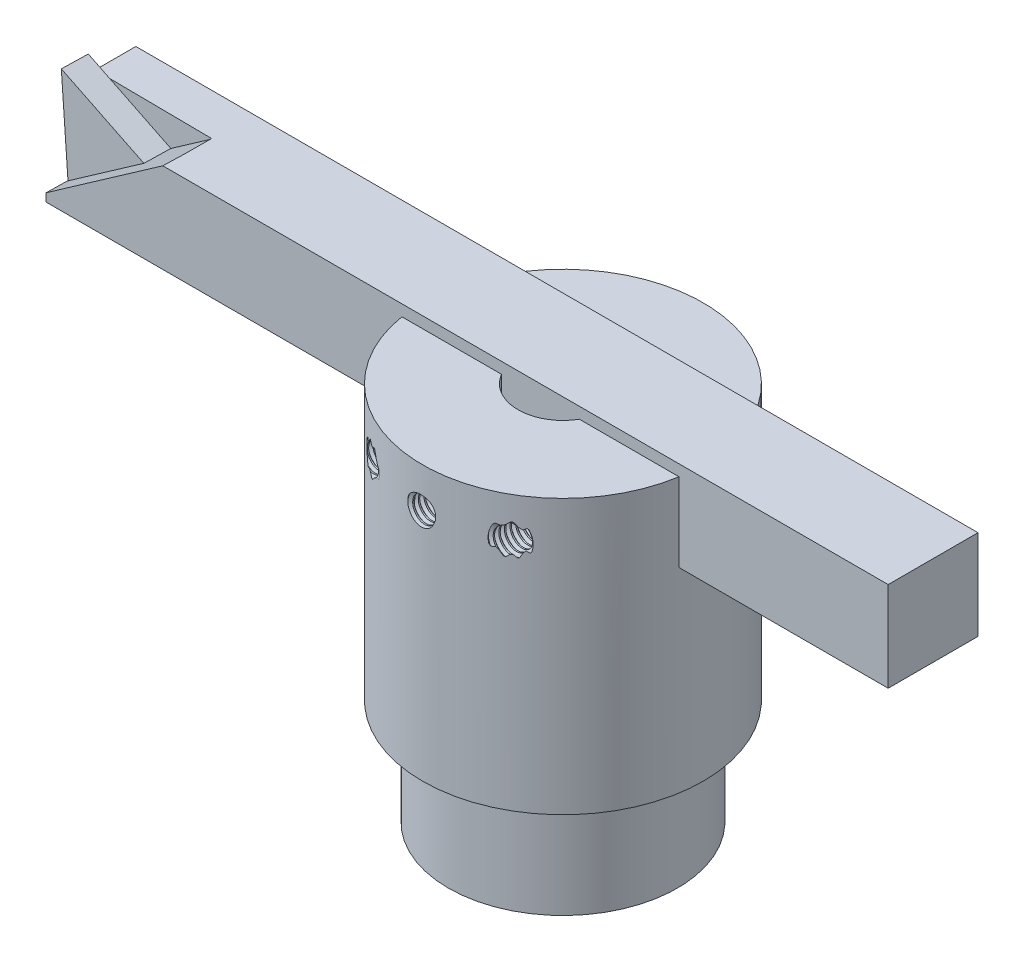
SolidWorks part; units mm, degrees
other "Arbor"
other "Fly Cutter Body"
other "Tool Holder"
other "Insert"
ref_plane "Front Plane" through (0, 0, 0) normal (0, 0, 1) x (1, 0, 0)
ref_plane "Top Plane" through (0, 0, 0) normal (0, 1, 0) x (1, 0, 0)
ref_plane "Right Plane" through (0, 0, 0) normal (1, 0, 0) x (0, 0, -1)
sketch "Sketch1" plane through (0, 0, 0) normal (0, 1, 0) x (1, 0, 0)
  circle A0 centre (0, 0) radius 20.4
  dimension "D1" = 40.8
extrude "Boss-Extrude1" add sketch "Sketch1" against normal blind 18.8
sketch "Sketch2" plane through (0, 0, 0) normal (0, 1, 0) x (1, 0, 0)
  circle A0 centre (0, 0) radius 10.97
  dimension "D1" = 21.94
extrude "Boss-Extrude2" add sketch "Sketch2" along normal blind 18
sketch "Sketch15" plane through (0, 18, 0) normal (0, 1, 0) x (1, 0, 0)
  circle A0 centre (0, 0) radius 4
  dimension "D1" = 8
extrude "Cut-Extrude2" cut sketch "Sketch15" against normal through all
thread "Thread1" pitch 1.5 start angle 0, offset 0, length 0, pitch 1.5, diameter 8
ref_plane "Plane1" through (-4, 18, 0) normal (0, 0, 1) x (-1, 0, 0)
sketch "Thread Profile1" plane through (-4, 18, 0) normal (0, 0, 1) x (-1, 0, 0)
  line L0 (0, 0) -> (0, 1.5) construction
  line L1 (0, 0) -> (0.8119, 0.4687)
  line L2 (0.8119, 0.4687) -> (0.8119, 0.6562)
  line L3 (0.8119, 0.6562) -> (0, 1.125)
  line L4 (0.8119, 0.5625) -> (0, 0.5625) construction
  line L11 (0, 0) -> (0, 1.125)
  point P2 (0, 0)
  dimension "Pitch" = 1.5
  dimension "Profile_Angle" = 60
  dimension "Profile_Land" = 0.1875
  dimension "Profile_Height" = 0.8119
sketch "Sketch22" plane through (0, 0, 0) normal (0, 1, 0) x (1, 0, 0)
  circle A0 centre (0, 0) radius 10.97 construction
  circle A1 centre (0, 0) radius 10.97
  circle A2 centre (0, 0) radius 25
  dimension "D1" = 50
extrude "Boss-Extrude5" add sketch "Sketch22" along normal blind 20.8 separate body contours A1 | A2
sketch "Sketch23" plane through (0, 20.8, 0) normal (0, 1, 0) x (1, 0, 0)
  circle A0 centre (0, 0) radius 25 construction
  circle A1 centre (0, 0) radius 25
extrude "Boss-Extrude6" add sketch "Sketch23" along normal blind 28 contours A1
sketch "Sketch24" plane through (0, 48.8, 0) normal (0, 1, 0) x (1, 0, 0)
  line L0 (-25, 0) -> (25, 0)
  line L6 (-30.1545, -4) -> (30.3335, -4)
  line L7 (-30.1545, -4) -> (-30.1545, 12)
  line L8 (-30.1545, 12) -> (30.3335, 12)
  line L9 (30.3335, -4) -> (30.3335, 12)
  circle A0 centre (0, 0) radius 25 construction
  dimension "D1" = 4
  dimension "D2" = 16
  dimension "D3" = 60.488
  dimension "D4" = 5.1545
extrude "Cut-Extrude4" cut sketch "Sketch24" against normal blind 14 contours L8 L7 L6 M5 | L8 L0 M5 | L6 L9 L8 M5 | L6 L0 M5
sketch "Sketch25" plane through (0, 0, 4) normal (0, 0, -1) x (-1, 0, 0)
  line L0 (-24.6779, 41.8) -> (24.6779, 41.8) construction
  line L1 (-24.6779, 34.8) -> (-24.6779, 48.8) construction
  line L2 (24.6779, 48.8) -> (24.6779, 34.8) construction
  line L3 (12.339, 41.8) -> (24.6779, 41.8)
  line L4 (12.339, 41.8) -> (0, 41.8)
  line L5 (0, 41.8) -> (-12.339, 41.8)
  line L6 (-12.339, 41.8) -> (-24.6779, 41.8)
  circle A0 centre (12.339, 41.8) radius 2.25
  circle A1 centre (0, 41.8) radius 2.25
  circle A2 centre (-12.339, 41.8) radius 2.25
  dimension "D1" = 4.5
extrude "Cut-Extrude5" cut sketch "Sketch25" against normal up to next contours A1 | A0 | A2
thread "Thread2" pitch 1 start angle 0, offset 0, length 30, pitch 1, diameter 4.5
ref_plane "Plane2" through (-14.589, 41.8, 4) normal (0, -1, 0) x (-1, 0, 0)
sketch "Thread Profile2" plane through (-14.589, 41.8, 4) normal (0, -1, 0) x (-1, 0, 0)
  line L0 (0, 0) -> (0, 1) construction
  line L1 (0, 0) -> (0.5413, 0.3125)
  line L2 (0.5413, 0.3125) -> (0.5413, 0.4375)
  line L3 (0.5413, 0.4375) -> (0, 0.75)
  line L4 (0.5413, 0.375) -> (0, 0.375) construction
  line L11 (0, 0) -> (0, 0.75)
  point P2 (0, 0)
  dimension "Pitch" = 1
  dimension "Profile_Angle" = 60
  dimension "Profile_Land" = 0.125
  dimension "Profile_Height" = 0.5413
thread "Thread3" pitch 1 start angle 0, offset 0, length 30, pitch 1, diameter 4.5
ref_plane "Plane3" through (2.25, 41.8, 4) normal (0, -1, 0) x (1, 0, 0)
sketch "Thread Profile3" plane through (2.25, 41.8, 4) normal (0, -1, 0) x (1, 0, 0)
  line L0 (0, 0) -> (0, 1) construction
  line L1 (0, 0) -> (0.5413, 0.3125)
  line L2 (0.5413, 0.3125) -> (0.5413, 0.4375)
  line L3 (0.5413, 0.4375) -> (0, 0.75)
  line L4 (0.5413, 0.375) -> (0, 0.375) construction
  line L11 (0, 0) -> (0, 0.75)
  point P2 (0, 0)
  dimension "Pitch" = 1
  dimension "Profile_Angle" = 60
  dimension "Profile_Land" = 0.125
  dimension "Profile_Height" = 0.5413
sketch "Sketch29" plane through (0, 20.8, 0) normal (0, -1, 0) x (1, 0, 0)
  circle A0 centre (0, 0) radius 5
  dimension "D1" = 10
extrude "Cut-Extrude6" cut sketch "Sketch29" against normal blind 14 contours A0
thread "Thread4" pitch 1 start angle 0, offset 0, length 30, pitch 1, diameter 4.5
ref_plane "Plane4" through (14.589, 41.8, 4) normal (0, -1, 0) x (1, 0, 0)
sketch "Thread Profile4" plane through (14.589, 41.8, 4) normal (0, -1, 0) x (1, 0, 0)
  line L0 (0, 0) -> (0, 1) construction
  line L1 (0, 0) -> (0.5413, 0.3125)
  line L2 (0.5413, 0.3125) -> (0.5413, 0.4375)
  line L3 (0.5413, 0.4375) -> (0, 0.75)
  line L4 (0.5413, 0.375) -> (0, 0.375) construction
  line L11 (0, 0) -> (0, 0.75)
  point P2 (0, 0)
  dimension "Pitch" = 1
  dimension "Profile_Angle" = 60
  dimension "Profile_Land" = 0.125
  dimension "Profile_Height" = 0.5413
sketch "Sketch30" plane through (0, 34.8, 0) normal (0, 1, 0) x (1, 0, 0)
  circle A0 centre (0, 0) radius 8
  dimension "D1" = 16
extrude "Cut-Extrude7" cut sketch "Sketch30" against normal blind 10 and the other way through all
sketch "Sketch35" plane through (0, 0, -12) normal (0, 0, 1) x (1, 0, 0)
  line L0 (21.9317, 34.8) -> (61.9317, 34.8)
  line L1 (61.9317, 34.8) -> (61.9317, 50.8)
  line L2 (61.9317, 50.8) -> (-88.0683, 50.8)
  line L3 (-88.0683, 50.8) -> (-88.0683, 34.8)
  line L4 (-88.0683, 34.8) -> (-21.9317, 34.8)
  line L5 (21.9317, 34.8) -> (21.9317, 48.8) construction
  line L6 (-21.9317, 34.8) -> (21.9317, 34.8) construction
  line L7 (-21.9317, 34.8) -> (21.9317, 34.8)
  dimension "D1" = 16
  dimension "D2" = 40
  dimension "D3" = 150
extrude "Boss-Extrude7" add sketch "Sketch35" along normal blind 16 separate body contours L2 L3 L4 L7 L0 L1
ref_plane "Plane6" through (-35.2265, -24.6659, 0) normal (-0.8192, -0.5736, 0) x (0, 0, -1)
sketch "Sketch38" plane through (-35.2265, -24.6659, 0) normal (-0.8192, -0.5736, 0) x (0, 0, -1)
  line L0 (0, -92.1268) -> (-0.2095, -80.1268)
  line L1 (-4, -92.1268) -> (12, -92.1268) construction
  line L3 (0, 38.6574) -> (0, -38.6574) construction
  line L4 (-0.2095, -80.1268) -> (-10.2095, -80.3014)
  line L5 (-10.2095, -80.3014) -> (-10, -92.3014)
  line L6 (-10, -92.3014) -> (0, -92.1268)
  dimension "D1" = 91
  dimension "D2" = 12
  dimension "D3" = 10
extrude "Cut-Extrude11" cut sketch "Sketch38" against normal up to next and the other way up to next
sketch "Sketch44" plane through (-0.0161, 0.023, 1.6076) normal (-0.01, 0.0143, 0.9998) x (0.9999, 0.0001, 0.01)
  line L0 (-67.1342, 50.7918) -> (-75.1592, 69.8444)
  line L1 (-75.1592, 69.8444) -> (-103.7639, 58.0309)
  line L2 (-103.7639, 58.0309) -> (-97.1024, 29.8111)
  line L3 (-97.1024, 29.8111) -> (-67.1342, 50.7918)
  line L5 (-88.0566, 36.144) -> (-67.1342, 50.7918) construction
extrude "Cut-Extrude12" cut sketch "Sketch44" against normal blind 4.76
ref_plane "Plane7" through (-0.0161, 0.023, 1.6076) normal (-0.01, 0.0143, 0.9998) x (0.9999, 0.0001, 0.01)
sketch "Sketch39" plane through (-0.0161, 0.023, 1.6076) normal (-0.01, 0.0143, 0.9998) x (0.9999, 0.0001, 0.01)
  line L0 (-74.415, 45.6945) -> (-87.9317, 36.2315)
  line L1 (-67.1629, 50.8599) -> (-88.1043, 50.8629) construction
  line L2 (-87.9317, 36.2315) -> (-89.3686, 52.6688)
  line L3 (-89.3686, 52.6688) -> (-74.415, 45.6945)
  line L4 (-88.1043, 36.1107) -> (-67.1342, 50.7918) construction
  line L5 (-88.1043, 50.8629) -> (-88.1043, 36.1107) construction
  line L6 (-67.1629, 50.8599) -> (-88.1043, 50.8629) construction
  line L7 (-88.1043, 50.8629) -> (-88.1043, 36.1107) construction
  line L8 (-88.1043, 50.8629) -> (-81.1733, 40.963) construction
  line L9 (-88.1043, 50.8629) -> (-94.7796, 60.3977) construction
  dimension "D1" = 16.5
extrude "Boss-Extrude9" add sketch "Sketch39" against normal blind 4.76 separate body
